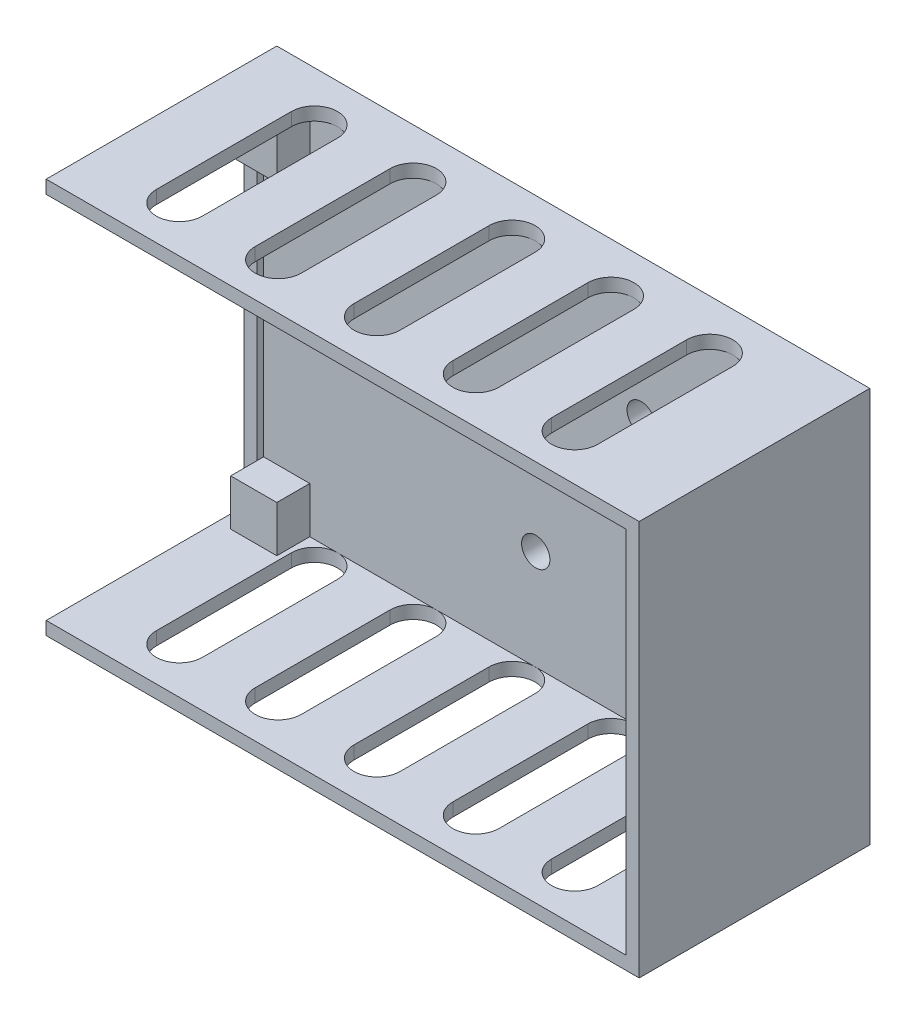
SolidWorks part; units mm, degrees
ref_plane "Plan de face" through (0, 0, 0) normal (0, 0, 1) x (1, 0, 0)
ref_plane "Plan de dessus" through (0, 0, 0) normal (0, 1, 0) x (1, 0, 0)
ref_plane "Plan de droite" through (0, 0, 0) normal (1, 0, 0) x (0, 0, -1)
sketch "Esquisse1" plane through (0, 0, 0) normal (0, 0, 1) x (1, 0, 0)
  line L1 (0, 0) -> (90, 0)
  line L2 (0, 0) -> (0, -60)
  line L3 (0, -60) -> (90, -60)
  line L4 (90, 0) -> (90, -60)
  dimension "D1" = 90
  dimension "D2" = 60
extrude "Boss.-Extru.1" add sketch "Esquisse1" along normal blind 35
sketch "Esquisse2" plane through (0, 0, 35) normal (0, 0, 1) x (1, 0, 0)
  line L8 (2, -2) -> (2, -58)
  line L9 (2, -58) -> (88, -58)
  line L10 (88, -58) -> (88, -2)
  line L11 (88, -2) -> (2, -2)
  line L12 (2, -2) -> (2, -58)
  line L13 (2, -58) -> (88, -58)
  line L14 (88, -58) -> (88, -2)
  line L15 (88, -2) -> (2, -2)
  dimension "D1" = 2
extrude "Enlèv. mat.-Extru.1" cut sketch "Esquisse2" against normal blind 31
sketch "Esquisse3" plane through (0, 0, 0) normal (0, 1, 0) x (1, 0, 0)
  line L0 (13.2105, -7.5) -> (13.2105, -28) construction
  line L1 (16.7105, -7.5) -> (16.7105, -28)
  line L2 (9.7105, -7.5) -> (9.7105, -28)
  line L12 (90, 0) -> (0, 0) construction
  line L13 (90, -35) -> (0, -35) construction
  line L14 (24.7105, -7.5) -> (24.7105, -28)
  line L15 (31.7105, -7.5) -> (31.7105, -28)
  line L16 (28.2105, -7.5) -> (28.2105, -28) construction
  line L17 (39.7105, -7.5) -> (39.7105, -28)
  line L18 (46.7105, -7.5) -> (46.7105, -28)
  line L19 (43.2105, -7.5) -> (43.2105, -28) construction
  line L20 (54.7105, -7.5) -> (54.7105, -28)
  line L21 (61.7105, -7.5) -> (61.7105, -28)
  line L22 (58.2105, -7.5) -> (58.2105, -28) construction
  line L23 (69.7105, -7.5) -> (69.7105, -28)
  line L24 (76.7105, -7.5) -> (76.7105, -28)
  line L25 (73.2105, -7.5) -> (73.2105, -28) construction
  line L29 (91.7105, -7.5) -> (91.7105, -28)
  line L30 (84.7105, -7.5) -> (84.7105, -28)
  arc A0 (16.7105, -7.5) -> (9.7105, -7.5) centre (13.2105, -7.5) ccw
  arc A1 (9.7105, -28) -> (16.7105, -28) centre (13.2105, -28) ccw
  arc A8 (31.7105, -7.5) -> (24.7105, -7.5) centre (28.2105, -7.5) ccw
  arc A9 (24.7105, -28) -> (31.7105, -28) centre (28.2105, -28) ccw
  arc A10 (46.7105, -7.5) -> (39.7105, -7.5) centre (43.2105, -7.5) ccw
  arc A11 (39.7105, -28) -> (46.7105, -28) centre (43.2105, -28) ccw
  arc A12 (61.7105, -7.5) -> (54.7105, -7.5) centre (58.2105, -7.5) ccw
  arc A13 (54.7105, -28) -> (61.7105, -28) centre (58.2105, -28) ccw
  arc A14 (76.7105, -7.5) -> (69.7105, -7.5) centre (73.2105, -7.5) ccw
  arc A15 (69.7105, -28) -> (76.7105, -28) centre (73.2105, -28) ccw
  arc A18 (91.7105, -7.5) -> (84.7105, -7.5) centre (88.2105, -7.5) ccw
  arc A19 (84.7105, -28) -> (91.7105, -28) centre (88.2105, -28) ccw
  point P2 (13.2105, -17.75)
  point P36 (28.2105, -17.75)
  point P43 (43.2105, -17.75)
  point P50 (58.2105, -17.75)
  point P57 (73.2105, -17.75)
  dimension "D3" = 3.5
  dimension "D1" = 7.5
  dimension "D2" = 7
  dimension "D4" = 6
extrude "Enlèv. mat.-Extru.2" cut sketch "Esquisse3" against normal through all
sketch "Esquisse4" plane through (0, 0, 0) normal (-1, 0, 0) x (0, 0, 1)
  line L0 (35, 0) -> (35, -60) construction
  line L1 (35, -2) -> (5, -2)
  line L2 (35, -2) -> (35, -58)
  line L3 (35, -58) -> (5, -58)
  line L4 (5, -2) -> (5, -58)
  line L5 (35, 0) -> (0, 0) construction
  line L6 (35, -60) -> (0, -60) construction
  dimension "D1" = 2
  dimension "D2" = 2
  dimension "D3" = 30
extrude "Enlèv. mat.-Extru.3" cut sketch "Esquisse4" against normal blind 3 contours L4 L3 L2 L1
sketch "Esquisse5" plane through (0, 0, 0) normal (0, 0, -1) x (-1, 0, 0)
  line L0 (0, -60) -> (-90, -60) construction
  line L1 (0, 0) -> (0, -60) construction
  circle A0 centre (-43.3, -42.8) radius 2.15
  circle A1 centre (-59.3, -17.23) radius 2.15
  dimension "D1" = 25.57
  dimension "D2" = 16
  dimension "D3" = 17.2
  dimension "D5" = 4.3
  dimension "D6" = 4.3
  dimension "D4" = 43.3
extrude "Enlèv. mat.-Extru.4" cut sketch "Esquisse5" against normal through all
sketch "Esquisse7" plane through (0, 0, 4) normal (0, 0, 1) x (1, 0, 0)
  line L0 (88, -2) -> (0, -2) construction
  line L1 (2, -2) -> (9, -2)
  line L2 (2, -2) -> (2, -9)
  line L3 (2, -9) -> (9, -9)
  line L4 (9, -2) -> (9, -9)
  line L5 (0, -58) -> (88, -58) construction
  line L6 (2, -58) -> (9, -58)
  line L7 (2, -58) -> (2, -51)
  line L8 (2, -51) -> (9, -51)
  line L9 (9, -58) -> (9, -51)
  line L10 (88, -58) -> (88, -2) construction
  line L11 (81, -51) -> (88, -51)
  line L12 (81, -51) -> (81, -58)
  line L13 (81, -58) -> (88, -58)
  line L14 (88, -51) -> (88, -58)
  line L15 (83, -2) -> (88, -2)
  line L16 (83, -2) -> (83, -9)
  line L17 (83, -9) -> (88, -9)
  line L18 (88, -2) -> (88, -9)
  line L19 (2, -2) -> (2, -58) construction
  dimension "D1" = 7
  dimension "D2" = 7
  dimension "D3" = 7
  dimension "D4" = 7
  dimension "D5" = 7
  dimension "D6" = 7
  dimension "D7" = 7
  dimension "D8" = 5
extrude "Boss.-Extru.2" add sketch "Esquisse7" along normal blind 5
